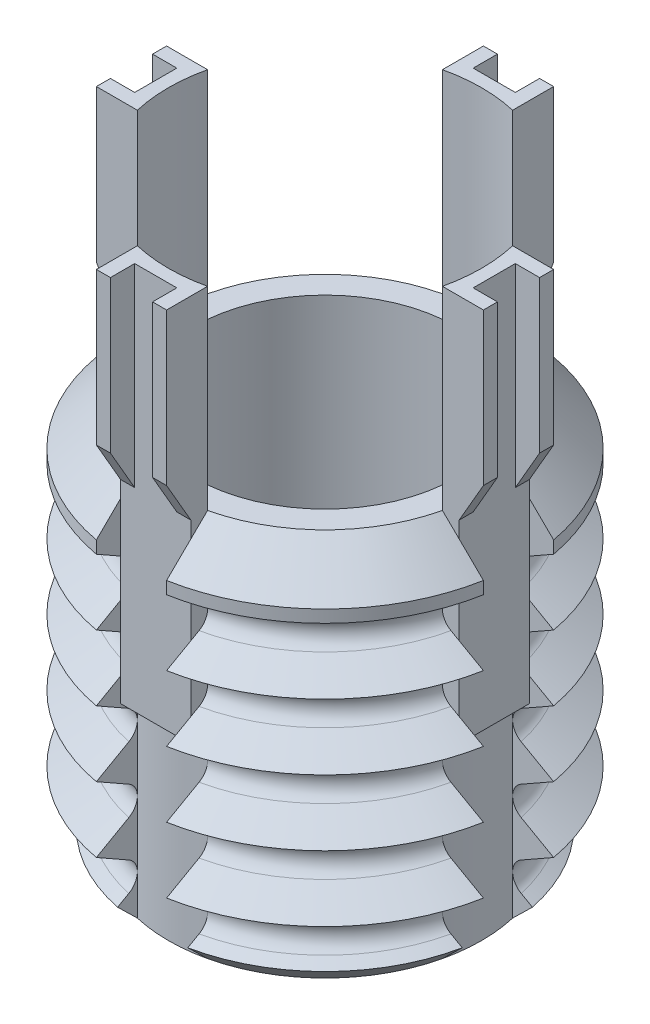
SolidWorks part; units mm, degrees
ref_plane "Front Plane" through (0, 0, 0) normal (0, 0, 1) x (1, 0, 0)
ref_plane "Top Plane" through (0, 0, 0) normal (0, 1, 0) x (1, 0, 0)
ref_plane "Right Plane" through (0, 0, 0) normal (1, 0, 0) x (0, 0, -1)
sketch "Sketch1" plane through (0, 0, 0) normal (0, 1, 0) x (1, 0, 0)
  circle A0 centre (0, 0) radius 4.7625
  circle A1 centre (0, 0) radius 3.175
  dimension "D1" = 6.35
  dimension "D2" = 9.525
extrude "Boss-Extrude1" add sketch "Sketch1" along normal mid plane 9.4
sketch "Sketch2" plane through (0, 4.7, 0) normal (0, 1, 0) x (1, 0, 0)
  circle A0 centre (0, 0) radius 3.79
  dimension "D1" = 7.58
extrude "Cut-Extrude1" cut sketch "Sketch2" against normal through all draft 45 flip side to cut
mirror "Mirror1" about plane through (0, 0, 0) normal (0, 1, 0) of "Cut-Extrude1"
sketch "Sketch3" plane through (0, 4.7, 0) normal (0, 1, 0) x (1, 0, 0)
  line L0 (-4.7625, 0) -> (-4.7625, 0.85)
  line L1 (-4.7625, 0.85) -> (-3.6935, 0.85)
  line L2 (-4.7625, 0) -> (-4.7625, -0.85)
  line L3 (-4.7625, -0.85) -> (-3.6935, -0.85)
  arc A0 (-3.6935, 0.85) -> (-3.6935, -0.85) centre (0, 0) ccw
  circle A1 centre (0, 0) radius 3.79 construction
  circle A2 centre (0, 0) radius 4.7625 construction
  dimension "D1" = 1.7
extrude "Cut-Extrude2" cut sketch "Sketch3" against normal through all
sketch "Sketch4" plane through (0, 0, 0) normal (0, 0, 1) x (1, 0, 0)
  line L1 (4.7625, -3.7275) -> (4.7625, -4.5225)
  line L3 (4.7625, -4.5225) -> (3.9922, -4.0778)
  line L6 (3.9922, -3.3772) -> (4.7625, -2.9325)
  line L10 (4.7625, -3.7275) -> (4.7625, 3.7275) construction
  line L12 (4.7625, -2.9325) -> (4.7625, -3.7275)
  arc A1 (3.9922, -4.0778) -> (3.9922, -3.3772) centre (4.1945, -3.7275) cw
  point P5 (3.79, -4.7)
  point P9 (3.79, -3.7275)
  dimension "D2" = 60
  dimension "D1" = 1.59
revolve "Cut-Revolve1" cut sketch "Sketch4" angle 360 about axis through (0, 4.7, 0) along (0, -1, 0)
pattern_linear "LPattern1" count 5 spacing 1.59 along (0, 1, 0) of "Cut-Revolve1"
sketch "Sketch5" plane through (0, 4.7, 0) normal (0, -1, 0) x (1, 0, 0)
  line L0 (-3.6935, 0.85) -> (-4.686, 0.85)
  line L1 (-3.6935, -0.85) -> (-4.686, -0.85)
  line L2 (-4.0984, -0.51) -> (-4.686, -0.51)
  line L3 (-4.0984, 0.51) -> (-4.686, 0.51)
  line L4 (-4.686, 0.85) -> (-4.686, 0.51)
  line L5 (-4.686, -0.51) -> (-4.686, -0.85)
  line L6 (-4.0984, 0.51) -> (-4.0984, -0.51)
  arc A0 (-3.6935, 0.85) -> (-3.6935, -0.85) centre (0, 0) ccw
  arc A1 (-3.6935, 0.85) -> (-3.6935, -0.85) centre (0, 0) ccw construction
  arc A3 (-4.0984, 0.51) -> (-4.0984, -0.51) centre (0, 0) ccw construction
  dimension "D1" = 0.34
extrude "Boss-Extrude2" add sketch "Sketch5" along normal mid plane 9.4
sketch "Sketch6" plane through (0, 0, 0) normal (0, 0, 1) x (1, 0, 0)
  line L9 (-4.0984, 4.7) -> (-4.686, 5.7178)
  line L10 (-4.0984, 0) -> (-4.0984, 9.4) construction
  line L11 (-4.686, 0) -> (-4.686, 9.4) construction
  line L12 (-4.686, 5.7178) -> (-4.686, 0)
  line L13 (-4.686, 0) -> (-4.0984, 0)
  line L15 (-4.0984, 0) -> (-4.0984, 4.7)
  line L16 (3.175, 4.7) -> (-3.175, 4.7) construction
  dimension "D1" = 150
extrude "Cut-Extrude3" cut sketch "Sketch6" against normal mid plane 1.7
pattern_circular "CirPattern1" count 4 over 360 about axis through (0, 0, 0) along (0, 1, 0) of "Cut-Extrude2", "Boss-Extrude2", "Cut-Extrude3"
